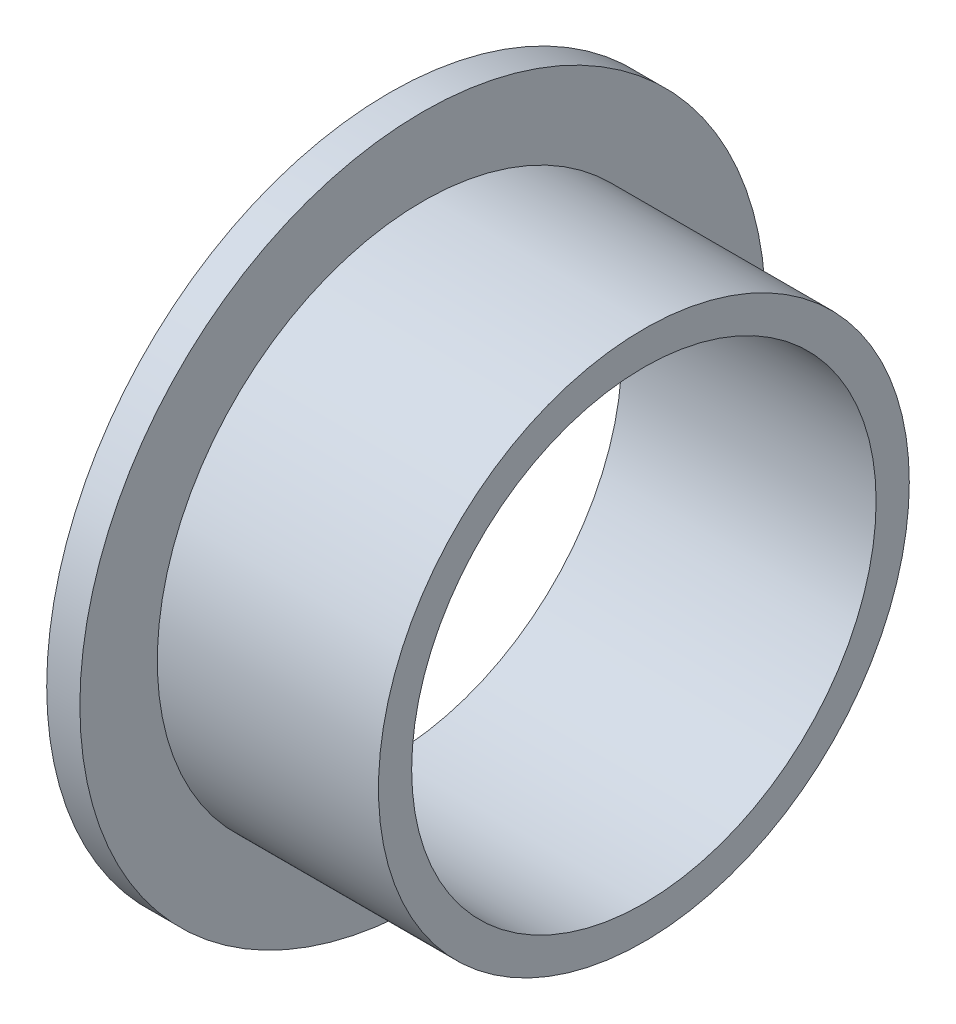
SolidWorks part; units mm, degrees
ref_plane "Front Plane" through (0, 0, 0) normal (0, 0, 1) x (1, 0, 0)
ref_plane "Top Plane" through (0, 0, 0) normal (0, 1, 0) x (1, 0, 0)
ref_plane "Right Plane" through (0, 0, 0) normal (1, 0, 0) x (0, 0, -1)
sketch "Sketch1" plane through (0, 0, 0) normal (0, 0, 1) x (1, 0, 0)
  line L0 (-46, 62) -> (-40, 62)
  line L1 (-40, 62) -> (-40, 48)
  line L2 (-40, 48) -> (0, 48)
  line L3 (0, 48) -> (0, 42)
  line L4 (0, 42) -> (-46, 42)
  line L5 (-46, 42) -> (-46, 62)
  line L6 (0, 0) -> (-22, 0) construction
  dimension "D1" = 46
  dimension "D2" = 6
  dimension "D3" = 6
  dimension "D4" = 42
  dimension "D5" = 20
revolve "Revolve1" add sketch "Sketch1" angle 360 about L6
